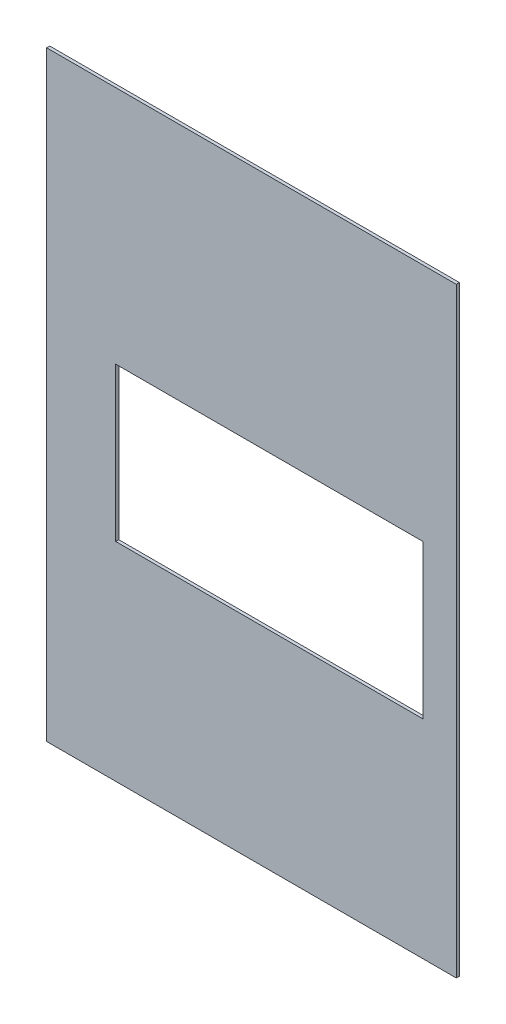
SolidWorks part; units mm, degrees
ref_plane "Front Plane" through (0, 0, 0) normal (0, 0, 1) x (1, 0, 0)
ref_plane "Top Plane" through (0, 0, 0) normal (0, 1, 0) x (1, 0, 0)
ref_plane "Right Plane" through (0, 0, 0) normal (1, 0, 0) x (0, 0, -1)
sketch "Sketch1" plane through (0, 0, 0) normal (0, 0, 1) x (1, 0, 0)
  line L1 (0, 1955.8) -> (1333.5, 1955.8)
  line L2 (0, 1955.8) -> (0, 0)
  line L3 (0, 0) -> (1333.5, 0)
  line L4 (1333.5, 1955.8) -> (1333.5, 0)
  line L7 (224.7933, 1176.3185) -> (1224.7933, 1176.3185)
  line L8 (224.7933, 1176.3185) -> (224.7933, 676.3185)
  line L9 (224.7933, 676.3185) -> (1224.7933, 676.3185)
  line L10 (1224.7933, 1176.3185) -> (1224.7933, 676.3185)
  dimension "D1" = 1000
  dimension "D2" = 500
  dimension "D3" = 1333.5
  dimension "D4" = 1955.8
  dimension "D5" = 676.3185
  dimension "D6" = 108.7067
extrude "Boss-Extrude1" add sketch "Sketch1" along normal blind 10
